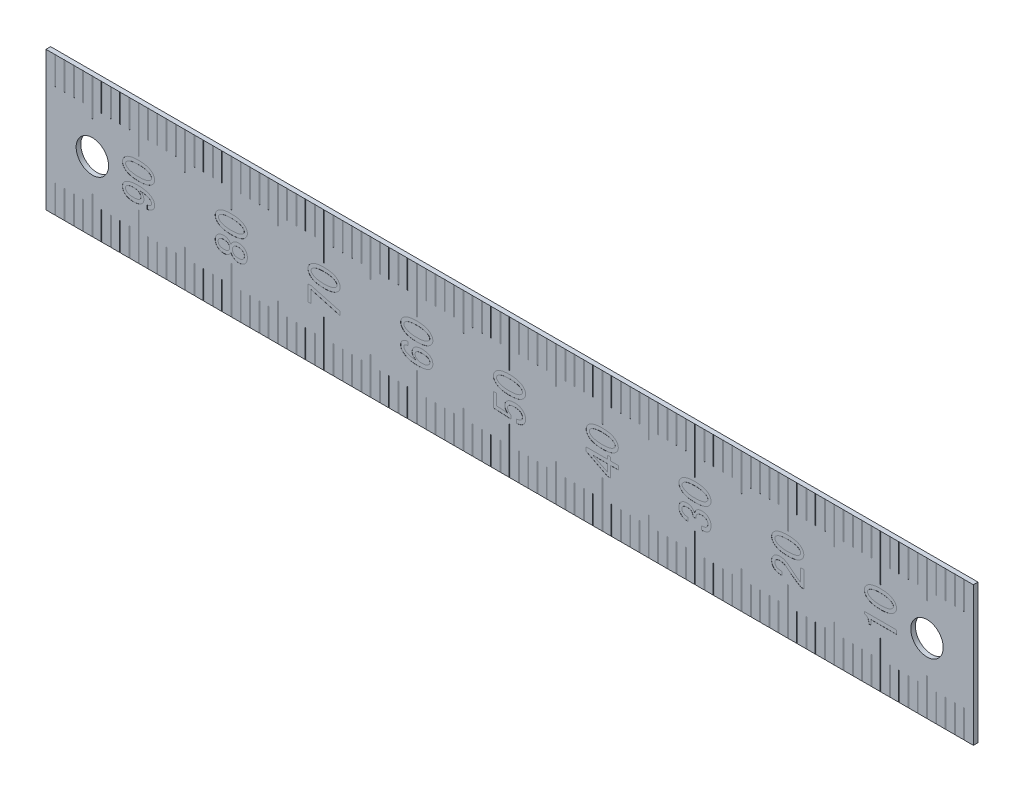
SolidWorks part; units mm, degrees
ref_plane "Front" through (0, 0, 0) normal (0, 0, 1) x (1, 0, 0)
ref_plane "Top" through (0, 0, 0) normal (0, 1, 0) x (1, 0, 0)
ref_plane "Right" through (0, 0, 0) normal (1, 0, 0) x (0, 0, -1)
sketch "Sketch1" plane through (0, 0, 0) normal (0, 0, 1) x (1, 0, 0)
  line L1 (0, -50) -> (0, 50)
  line L2 (0, -50) -> (15, -50)
  line L3 (15, -50) -> (15, 50)
  line L4 (0, 50) -> (15, 50)
  dimension "D1" = 100
  dimension "D2" = 15
extrude "Extrude1" add sketch "Sketch1" along normal blind 0.5
sketch "Sketch2" plane through (0, 0, 0.5) normal (0, 0, 1) x (1, 0, 0)
  line L0 (0, 50) -> (0, -50) construction
  line L1 (0, -50) -> (15, -50) construction
  line L2 (15, 50) -> (0, 50) construction
  circle A0 centre (7.5, -45) radius 1.75
  circle A1 centre (7.5, 45) radius 1.75
  dimension "D1" = 7.5
  dimension "D2" = 7.5
  dimension "D3" = 5
  dimension "D4" = 5
  dimension "D5" = 3.5
  dimension "D6" = 3.5
extrude "Extrude2" cut sketch "Sketch2" against normal through all
sketch "Sketch3" plane through (0, 0, 0.5) normal (0, 0, 1) x (1, 0, 0)
  line L0 (15, 50) -> (0, 50) construction
  line L1 (5.25, 28.25) -> (9.75, 28.25) construction
  line L2 (5.25, 18.25) -> (9.75, 18.25) construction
  line L3 (5.25, 8.25) -> (9.75, 8.25) construction
  line L5 (0, 50) -> (0, -50) construction
  line L6 (5.25, -1.75) -> (9.75, -1.75) construction
  line L7 (5.25, 38.25) -> (9.75, 38.25) construction
  line L8 (5.25, 38.25) -> (5.25, 41.75) construction
  line L9 (7.5, -50) -> (7.5, 50) construction
  line L10 (0, -50) -> (15, -50) construction
  line L11 (0, 40) -> (15, 40) construction
  line L12 (15, -50) -> (15, 50) construction
  line L13 (5.25, 41.75) -> (9.75, 41.75) construction
  line L14 (9.75, 38.25) -> (9.75, 41.75) construction
  line L15 (5.25, 38.25) -> (9.75, 41.75) construction
  line L16 (5.25, 41.75) -> (9.75, 38.25) construction
  line L17 (5.25, -11.75) -> (9.75, -11.75) construction
  line L18 (5.25, -21.75) -> (9.75, -21.75) construction
  line L19 (5.25, -31.75) -> (9.75, -31.75) construction
  line L20 (5.25, -41.75) -> (9.75, -41.75) construction
  circle A0 centre (7.5, 45) radius 1.75 construction
  text T0 "90" font "ＭＳ ゴシック" height 3.5
  text T1 "80" font "ＭＳ ゴシック" height 3.5
  text T2 "70" font "ＭＳ ゴシック" height 3.5
  text T3 "60" font "ＭＳ ゴシック" height 3.5
  text T4 "50  "
  text T5 "40"
  text T6 "30"
  text T7 "20"
  text T8 "10"
  point P7 (7.5, 40)
  dimension "D2" = 7.5
  dimension "D1" = 4
  dimension "D3" = 6
  dimension "D6" = 10
  dimension "D5" = 4.5
  dimension "D7" = 3.5
extrude "Extrude3" cut sketch "Sketch3" against normal blind 0.01
sketch "Sketch4" plane through (0, 0, 0.5) normal (0, 0, 1) x (1, 0, 0)
  line L0 (15, 40.05) -> (10, 40.05)
  line L1 (15, -50) -> (15, 50) construction
  line L2 (10, 40.05) -> (10, 39.95)
  line L3 (10, 39.95) -> (15, 39.95)
  line L4 (15, 39.95) -> (15, 40.05)
  line L5 (15, 50) -> (0, 50) construction
  line L6 (15, 48.05) -> (15, 47.95)
  line L7 (15, 44.95) -> (11, 44.95)
  line L8 (15, 44.95) -> (15, 45.05)
  line L9 (15, 45.05) -> (11, 45.05)
  line L10 (11, 44.95) -> (11, 45.05)
  line L11 (15, 49.05) -> (12, 49.05)
  line L12 (15, 49.05) -> (15, 48.95)
  line L13 (15, 48.95) -> (12, 48.95)
  line L14 (12, 49.05) -> (12, 48.95)
  line L15 (15, 48.05) -> (12, 48.05)
  line L16 (15, 47.95) -> (12, 47.95)
  line L17 (12, 48.05) -> (12, 47.95)
  line L18 (15, 47.05) -> (15, 46.95)
  line L19 (15, 47.05) -> (12, 47.05)
  line L20 (15, 46.95) -> (12, 46.95)
  line L21 (12, 47.05) -> (12, 46.95)
  line L22 (15, 46.05) -> (15, 45.95)
  line L23 (15, 46.05) -> (12, 46.05)
  line L24 (15, 45.95) -> (12, 45.95)
  line L25 (12, 46.05) -> (12, 45.95)
  line L26 (15, 30.05) -> (10, 30.05)
  line L27 (10, 30.05) -> (10, 29.95)
  line L28 (10, 29.95) -> (15, 29.95)
  line L29 (15, 29.95) -> (15, 30.05)
  line L30 (15, 44.05) -> (15, 43.95)
  line L31 (15, 44.05) -> (12, 44.05)
  line L32 (15, 43.95) -> (12, 43.95)
  line L33 (12, 44.05) -> (12, 43.95)
  line L34 (15, 43.05) -> (15, 42.95)
  line L35 (15, 43.05) -> (12, 43.05)
  line L36 (15, 42.95) -> (12, 42.95)
  line L37 (12, 43.05) -> (12, 42.95)
  line L38 (15, 42.05) -> (15, 41.95)
  line L39 (15, 42.05) -> (12, 42.05)
  line L40 (15, 41.95) -> (12, 41.95)
  line L41 (12, 42.05) -> (12, 41.95)
  line L42 (15, 41.05) -> (15, 40.95)
  line L43 (15, 41.05) -> (12, 41.05)
  line L44 (15, 40.95) -> (12, 40.95)
  line L45 (12, 41.05) -> (12, 40.95)
  line L46 (12, 45.05) -> (12, 44.95)
  line L47 (15, 45.05) -> (12, 45.05)
  line L48 (15, 44.95) -> (12, 44.95)
  line L49 (15, 45.05) -> (15, 44.95)
  line L50 (15, 38.05) -> (15, 37.95)
  line L51 (15, 34.95) -> (11, 34.95)
  line L52 (15, 34.95) -> (15, 35.05)
  line L53 (15, 35.05) -> (11, 35.05)
  line L54 (11, 34.95) -> (11, 35.05)
  line L55 (15, 39.05) -> (12, 39.05)
  line L56 (15, 39.05) -> (15, 38.95)
  line L57 (15, 38.95) -> (12, 38.95)
  line L58 (12, 39.05) -> (12, 38.95)
  line L59 (15, 38.05) -> (12, 38.05)
  line L60 (15, 37.95) -> (12, 37.95)
  line L61 (12, 38.05) -> (12, 37.95)
  line L62 (15, 37.05) -> (15, 36.95)
  line L63 (15, 37.05) -> (12, 37.05)
  line L64 (15, 36.95) -> (12, 36.95)
  line L65 (12, 37.05) -> (12, 36.95)
  line L66 (15, 36.05) -> (15, 35.95)
  line L67 (15, 36.05) -> (12, 36.05)
  line L68 (15, 35.95) -> (12, 35.95)
  line L69 (12, 36.05) -> (12, 35.95)
  line L70 (15, 34.05) -> (15, 33.95)
  line L71 (15, 34.05) -> (12, 34.05)
  line L72 (15, 33.95) -> (12, 33.95)
  line L73 (12, 34.05) -> (12, 33.95)
  line L74 (15, 33.05) -> (15, 32.95)
  line L75 (15, 33.05) -> (12, 33.05)
  line L76 (15, 32.95) -> (12, 32.95)
  line L77 (12, 33.05) -> (12, 32.95)
  line L78 (15, 32.05) -> (15, 31.95)
  line L79 (15, 32.05) -> (12, 32.05)
  line L80 (15, 31.95) -> (12, 31.95)
  line L81 (12, 32.05) -> (12, 31.95)
  line L82 (15, 31.05) -> (15, 30.95)
  line L83 (15, 31.05) -> (12, 31.05)
  line L84 (15, 30.95) -> (12, 30.95)
  line L85 (12, 31.05) -> (12, 30.95)
  line L86 (15, 20.05) -> (10, 20.05)
  line L87 (10, 20.05) -> (10, 19.95)
  line L88 (10, 19.95) -> (15, 19.95)
  line L89 (15, 19.95) -> (15, 20.05)
  line L90 (15, 28.05) -> (15, 27.95)
  line L91 (15, 24.95) -> (11, 24.95)
  line L92 (15, 24.95) -> (15, 25.05)
  line L93 (15, 25.05) -> (11, 25.05)
  line L94 (11, 24.95) -> (11, 25.05)
  line L95 (15, 29.05) -> (12, 29.05)
  line L96 (15, 29.05) -> (15, 28.95)
  line L97 (15, 28.95) -> (12, 28.95)
  line L98 (12, 29.05) -> (12, 28.95)
  line L99 (15, 28.05) -> (12, 28.05)
  line L100 (15, 27.95) -> (12, 27.95)
  line L101 (12, 28.05) -> (12, 27.95)
  line L102 (15, 27.05) -> (15, 26.95)
  line L103 (15, 27.05) -> (12, 27.05)
  line L104 (15, 26.95) -> (12, 26.95)
  line L105 (12, 27.05) -> (12, 26.95)
  line L106 (15, 26.05) -> (15, 25.95)
  line L107 (15, 26.05) -> (12, 26.05)
  line L108 (15, 25.95) -> (12, 25.95)
  line L109 (12, 26.05) -> (12, 25.95)
  line L110 (15, 24.05) -> (15, 23.95)
  line L111 (15, 24.05) -> (12, 24.05)
  line L112 (15, 23.95) -> (12, 23.95)
  line L113 (12, 24.05) -> (12, 23.95)
  line L114 (15, 23.05) -> (15, 22.95)
  line L115 (15, 23.05) -> (12, 23.05)
  line L116 (15, 22.95) -> (12, 22.95)
  line L117 (12, 23.05) -> (12, 22.95)
  line L118 (15, 22.05) -> (15, 21.95)
  line L119 (15, 22.05) -> (12, 22.05)
  line L120 (15, 21.95) -> (12, 21.95)
  line L121 (12, 22.05) -> (12, 21.95)
  line L122 (15, 21.05) -> (15, 20.95)
  line L123 (15, 21.05) -> (12, 21.05)
  line L124 (15, 20.95) -> (12, 20.95)
  line L125 (12, 21.05) -> (12, 20.95)
  line L126 (15, 10.05) -> (10, 10.05)
  line L127 (10, 10.05) -> (10, 9.95)
  line L128 (10, 9.95) -> (15, 9.95)
  line L129 (15, 9.95) -> (15, 10.05)
  line L130 (15, 18.05) -> (15, 17.95)
  line L131 (15, 14.95) -> (11, 14.95)
  line L132 (15, 14.95) -> (15, 15.05)
  line L133 (15, 15.05) -> (11, 15.05)
  line L134 (11, 14.95) -> (11, 15.05)
  line L135 (15, 19.05) -> (12, 19.05)
  line L136 (15, 19.05) -> (15, 18.95)
  line L137 (15, 18.95) -> (12, 18.95)
  line L138 (12, 19.05) -> (12, 18.95)
  line L139 (15, 18.05) -> (12, 18.05)
  line L140 (15, 17.95) -> (12, 17.95)
  line L141 (12, 18.05) -> (12, 17.95)
  line L142 (15, 17.05) -> (15, 16.95)
  line L143 (15, 17.05) -> (12, 17.05)
  line L144 (15, 16.95) -> (12, 16.95)
  line L145 (12, 17.05) -> (12, 16.95)
  line L146 (15, 16.05) -> (15, 15.95)
  line L147 (15, 16.05) -> (12, 16.05)
  line L148 (15, 15.95) -> (12, 15.95)
  line L149 (12, 16.05) -> (12, 15.95)
  line L150 (15, 14.05) -> (15, 13.95)
  line L151 (15, 14.05) -> (12, 14.05)
  line L152 (15, 13.95) -> (12, 13.95)
  line L153 (12, 14.05) -> (12, 13.95)
  line L154 (15, 13.05) -> (15, 12.95)
  line L155 (15, 13.05) -> (12, 13.05)
  line L156 (15, 12.95) -> (12, 12.95)
  line L157 (12, 13.05) -> (12, 12.95)
  line L158 (15, 12.05) -> (15, 11.95)
  line L159 (15, 12.05) -> (12, 12.05)
  line L160 (15, 11.95) -> (12, 11.95)
  line L161 (12, 12.05) -> (12, 11.95)
  line L162 (15, 11.05) -> (15, 10.95)
  line L163 (15, 11.05) -> (12, 11.05)
  line L164 (15, 10.95) -> (12, 10.95)
  line L165 (12, 11.05) -> (12, 10.95)
  line L166 (7.5, 50) -> (7.5, 36.693) construction
  line L167 (3, 1.05) -> (3, 0.95)
  line L168 (0, 0.95) -> (3, 0.95)
  line L169 (0, 1.05) -> (3, 1.05)
  line L170 (15, 8.05) -> (15, 7.95)
  line L171 (15, 4.95) -> (11, 4.95)
  line L172 (15, 4.95) -> (15, 5.05)
  line L173 (15, 5.05) -> (11, 5.05)
  line L174 (11, 4.95) -> (11, 5.05)
  line L175 (15, 9.05) -> (12, 9.05)
  line L176 (15, 9.05) -> (15, 8.95)
  line L177 (15, 8.95) -> (12, 8.95)
  line L178 (12, 9.05) -> (12, 8.95)
  line L179 (15, 8.05) -> (12, 8.05)
  line L180 (15, 7.95) -> (12, 7.95)
  line L181 (12, 8.05) -> (12, 7.95)
  line L182 (15, 7.05) -> (15, 6.95)
  line L183 (15, 7.05) -> (12, 7.05)
  line L184 (15, 6.95) -> (12, 6.95)
  line L185 (12, 7.05) -> (12, 6.95)
  line L186 (15, 6.05) -> (15, 5.95)
  line L187 (15, 6.05) -> (12, 6.05)
  line L188 (15, 5.95) -> (12, 5.95)
  line L189 (12, 6.05) -> (12, 5.95)
  line L190 (15, 4.05) -> (15, 3.95)
  line L191 (15, 4.05) -> (12, 4.05)
  line L192 (15, 3.95) -> (12, 3.95)
  line L193 (12, 4.05) -> (12, 3.95)
  line L194 (15, 3.05) -> (15, 2.95)
  line L195 (15, 3.05) -> (12, 3.05)
  line L196 (15, 2.95) -> (12, 2.95)
  line L197 (12, 3.05) -> (12, 2.95)
  line L198 (15, 2.05) -> (15, 1.95)
  line L199 (15, 2.05) -> (12, 2.05)
  line L200 (15, 1.95) -> (12, 1.95)
  line L201 (12, 2.05) -> (12, 1.95)
  line L202 (15, 1.05) -> (15, 0.95)
  line L203 (15, 1.05) -> (12, 1.05)
  line L204 (15, 0.95) -> (12, 0.95)
  line L205 (12, 1.05) -> (12, 0.95)
  line L206 (15, 0.05) -> (10, 0.05)
  line L207 (10, 0.05) -> (10, -0.05)
  line L208 (10, -0.05) -> (15, -0.05)
  line L209 (15, -0.05) -> (15, 0.05)
  line L210 (0, 1.05) -> (0, 0.95)
  line L211 (3, 2.05) -> (3, 1.95)
  line L212 (0, 1.95) -> (3, 1.95)
  line L213 (0, 2.05) -> (3, 2.05)
  line L214 (0, 2.05) -> (0, 1.95)
  line L215 (3, 3.05) -> (3, 2.95)
  line L216 (0, 2.95) -> (3, 2.95)
  line L217 (0, 3.05) -> (3, 3.05)
  line L218 (0, 3.05) -> (0, 2.95)
  line L219 (3, 4.05) -> (3, 3.95)
  line L220 (0, 3.95) -> (3, 3.95)
  line L221 (0, 4.05) -> (3, 4.05)
  line L222 (0, 4.05) -> (0, 3.95)
  line L223 (3, 6.05) -> (3, 5.95)
  line L224 (0, 5.95) -> (3, 5.95)
  line L225 (0, 6.05) -> (3, 6.05)
  line L226 (0, 6.05) -> (0, 5.95)
  line L227 (3, 7.05) -> (3, 6.95)
  line L228 (0, 6.95) -> (3, 6.95)
  line L229 (0, 7.05) -> (3, 7.05)
  line L230 (0, 7.05) -> (0, 6.95)
  line L231 (3, 8.05) -> (3, 7.95)
  line L232 (0, 7.95) -> (3, 7.95)
  line L233 (0, 8.05) -> (3, 8.05)
  line L234 (3, 9.05) -> (3, 8.95)
  line L235 (0, 8.95) -> (3, 8.95)
  line L236 (0, 9.05) -> (0, 8.95)
  line L237 (0, 9.05) -> (3, 9.05)
  line L238 (4, 4.95) -> (4, 5.05)
  line L239 (0, 5.05) -> (4, 5.05)
  line L240 (0, 4.95) -> (0, 5.05)
  line L241 (0, 4.95) -> (4, 4.95)
  line L242 (0, 8.05) -> (0, 7.95)
  line L243 (3, 11.05) -> (3, 10.95)
  line L244 (0, 10.95) -> (3, 10.95)
  line L245 (0, 11.05) -> (3, 11.05)
  line L246 (0, 11.05) -> (0, 10.95)
  line L247 (3, 12.05) -> (3, 11.95)
  line L248 (0, 11.95) -> (3, 11.95)
  line L249 (0, 12.05) -> (3, 12.05)
  line L250 (0, 12.05) -> (0, 11.95)
  line L251 (3, 13.05) -> (3, 12.95)
  line L252 (0, 12.95) -> (3, 12.95)
  line L253 (0, 13.05) -> (3, 13.05)
  line L254 (0, 13.05) -> (0, 12.95)
  line L255 (3, 14.05) -> (3, 13.95)
  line L256 (0, 13.95) -> (3, 13.95)
  line L257 (0, 14.05) -> (3, 14.05)
  line L258 (0, 14.05) -> (0, 13.95)
  line L259 (3, 16.05) -> (3, 15.95)
  line L260 (0, 15.95) -> (3, 15.95)
  line L261 (0, 16.05) -> (3, 16.05)
  line L262 (0, 16.05) -> (0, 15.95)
  line L263 (3, 17.05) -> (3, 16.95)
  line L264 (0, 16.95) -> (3, 16.95)
  line L265 (0, 17.05) -> (3, 17.05)
  line L266 (0, 17.05) -> (0, 16.95)
  line L267 (3, 18.05) -> (3, 17.95)
  line L268 (0, 17.95) -> (3, 17.95)
  line L269 (0, 18.05) -> (3, 18.05)
  line L270 (3, 19.05) -> (3, 18.95)
  line L271 (0, 18.95) -> (3, 18.95)
  line L272 (0, 19.05) -> (0, 18.95)
  line L273 (0, 19.05) -> (3, 19.05)
  line L274 (4, 14.95) -> (4, 15.05)
  line L275 (0, 15.05) -> (4, 15.05)
  line L276 (0, 14.95) -> (0, 15.05)
  line L277 (0, 14.95) -> (4, 14.95)
  line L278 (0, 18.05) -> (0, 17.95)
  line L279 (0, 9.95) -> (0, 10.05)
  line L280 (5, 9.95) -> (0, 9.95)
  line L281 (5, 10.05) -> (5, 9.95)
  line L282 (0, 10.05) -> (5, 10.05)
  line L283 (3, 21.05) -> (3, 20.95)
  line L284 (0, 20.95) -> (3, 20.95)
  line L285 (0, 21.05) -> (3, 21.05)
  line L286 (0, 21.05) -> (0, 20.95)
  line L287 (3, 22.05) -> (3, 21.95)
  line L288 (0, 21.95) -> (3, 21.95)
  line L289 (0, 22.05) -> (3, 22.05)
  line L290 (0, 22.05) -> (0, 21.95)
  line L291 (3, 23.05) -> (3, 22.95)
  line L292 (0, 22.95) -> (3, 22.95)
  line L293 (0, 23.05) -> (3, 23.05)
  line L294 (0, 23.05) -> (0, 22.95)
  line L295 (3, 24.05) -> (3, 23.95)
  line L296 (0, 23.95) -> (3, 23.95)
  line L297 (0, 24.05) -> (3, 24.05)
  line L298 (0, 24.05) -> (0, 23.95)
  line L299 (3, 26.05) -> (3, 25.95)
  line L300 (0, 25.95) -> (3, 25.95)
  line L301 (0, 26.05) -> (3, 26.05)
  line L302 (0, 26.05) -> (0, 25.95)
  line L303 (3, 27.05) -> (3, 26.95)
  line L304 (0, 26.95) -> (3, 26.95)
  line L305 (0, 27.05) -> (3, 27.05)
  line L306 (0, 27.05) -> (0, 26.95)
  line L307 (3, 28.05) -> (3, 27.95)
  line L308 (0, 27.95) -> (3, 27.95)
  line L309 (0, 28.05) -> (3, 28.05)
  line L310 (3, 29.05) -> (3, 28.95)
  line L311 (0, 28.95) -> (3, 28.95)
  line L312 (0, 29.05) -> (0, 28.95)
  line L313 (0, 29.05) -> (3, 29.05)
  line L314 (4, 24.95) -> (4, 25.05)
  line L315 (0, 25.05) -> (4, 25.05)
  line L316 (0, 24.95) -> (0, 25.05)
  line L317 (0, 24.95) -> (4, 24.95)
  line L318 (0, 28.05) -> (0, 27.95)
  line L319 (0, 19.95) -> (0, 20.05)
  line L320 (5, 19.95) -> (0, 19.95)
  line L321 (5, 20.05) -> (5, 19.95)
  line L322 (0, 20.05) -> (5, 20.05)
  line L323 (3, 31.05) -> (3, 30.95)
  line L324 (0, 30.95) -> (3, 30.95)
  line L325 (0, 31.05) -> (3, 31.05)
  line L326 (0, 31.05) -> (0, 30.95)
  line L327 (3, 32.05) -> (3, 31.95)
  line L328 (0, 31.95) -> (3, 31.95)
  line L329 (0, 32.05) -> (3, 32.05)
  line L330 (0, 32.05) -> (0, 31.95)
  line L331 (3, 33.05) -> (3, 32.95)
  line L332 (0, 32.95) -> (3, 32.95)
  line L333 (0, 33.05) -> (3, 33.05)
  line L334 (0, 33.05) -> (0, 32.95)
  line L335 (3, 34.05) -> (3, 33.95)
  line L336 (0, 33.95) -> (3, 33.95)
  line L337 (0, 34.05) -> (3, 34.05)
  line L338 (0, 34.05) -> (0, 33.95)
  line L339 (3, 36.05) -> (3, 35.95)
  line L340 (0, 35.95) -> (3, 35.95)
  line L341 (0, 36.05) -> (3, 36.05)
  line L342 (0, 36.05) -> (0, 35.95)
  line L343 (3, 37.05) -> (3, 36.95)
  line L344 (0, 36.95) -> (3, 36.95)
  line L345 (0, 37.05) -> (3, 37.05)
  line L346 (0, 37.05) -> (0, 36.95)
  line L347 (3, 38.05) -> (3, 37.95)
  line L348 (0, 37.95) -> (3, 37.95)
  line L349 (0, 38.05) -> (3, 38.05)
  line L350 (3, 39.05) -> (3, 38.95)
  line L351 (0, 38.95) -> (3, 38.95)
  line L352 (0, 39.05) -> (0, 38.95)
  line L353 (0, 39.05) -> (3, 39.05)
  line L354 (4, 34.95) -> (4, 35.05)
  line L355 (0, 35.05) -> (4, 35.05)
  line L356 (0, 34.95) -> (0, 35.05)
  line L357 (0, 34.95) -> (4, 34.95)
  line L358 (0, 38.05) -> (0, 37.95)
  line L359 (3, 41.05) -> (3, 40.95)
  line L360 (0, 40.95) -> (3, 40.95)
  line L361 (0, 41.05) -> (3, 41.05)
  line L362 (0, 41.05) -> (0, 40.95)
  line L363 (3, 42.05) -> (3, 41.95)
  line L364 (0, 41.95) -> (3, 41.95)
  line L365 (0, 42.05) -> (3, 42.05)
  line L366 (0, 42.05) -> (0, 41.95)
  line L367 (3, 43.05) -> (3, 42.95)
  line L368 (0, 42.95) -> (3, 42.95)
  line L369 (0, 43.05) -> (3, 43.05)
  line L370 (0, 43.05) -> (0, 42.95)
  line L371 (3, 44.05) -> (3, 43.95)
  line L372 (0, 43.95) -> (3, 43.95)
  line L373 (0, 44.05) -> (3, 44.05)
  line L374 (0, 44.05) -> (0, 43.95)
  line L375 (0, 29.95) -> (0, 30.05)
  line L376 (5, 29.95) -> (0, 29.95)
  line L377 (5, 30.05) -> (5, 29.95)
  line L378 (0, 30.05) -> (5, 30.05)
  line L379 (3, 46.05) -> (3, 45.95)
  line L380 (0, 45.95) -> (3, 45.95)
  line L381 (0, 46.05) -> (3, 46.05)
  line L382 (0, 46.05) -> (0, 45.95)
  line L383 (3, 47.05) -> (3, 46.95)
  line L384 (0, 46.95) -> (3, 46.95)
  line L385 (0, 47.05) -> (3, 47.05)
  line L386 (0, 47.05) -> (0, 46.95)
  line L387 (3, 48.05) -> (3, 47.95)
  line L388 (0, 47.95) -> (3, 47.95)
  line L389 (0, 48.05) -> (3, 48.05)
  line L390 (3, 49.05) -> (3, 48.95)
  line L391 (0, 48.95) -> (3, 48.95)
  line L392 (0, 49.05) -> (0, 48.95)
  line L393 (0, 49.05) -> (3, 49.05)
  line L394 (4, 44.95) -> (4, 45.05)
  line L395 (0, 45.05) -> (4, 45.05)
  line L396 (0, 44.95) -> (0, 45.05)
  line L397 (0, 44.95) -> (4, 44.95)
  line L398 (0, 48.05) -> (0, 47.95)
  line L399 (0, 39.95) -> (0, 40.05)
  line L400 (5, 39.95) -> (0, 39.95)
  line L401 (5, 40.05) -> (5, 39.95)
  line L402 (0, 40.05) -> (5, 40.05)
  line L403 (15, 0.05) -> (10, 0.05)
  line L404 (10, 0.05) -> (10, -0.05)
  line L405 (10, -0.05) -> (15, -0.05)
  line L406 (15, -0.05) -> (15, 0.05)
  line L407 (3, -8.95) -> (3, -9.05)
  line L408 (0, -9.05) -> (3, -9.05)
  line L409 (0, -8.95) -> (3, -8.95)
  line L410 (15, -1.95) -> (15, -2.05)
  line L411 (15, -5.05) -> (11, -5.05)
  line L412 (15, -5.05) -> (15, -4.95)
  line L413 (15, -4.95) -> (11, -4.95)
  line L414 (11, -5.05) -> (11, -4.95)
  line L415 (15, -0.95) -> (12, -0.95)
  line L416 (15, -0.95) -> (15, -1.05)
  line L417 (15, -1.05) -> (12, -1.05)
  line L418 (12, -0.95) -> (12, -1.05)
  line L419 (15, -1.95) -> (12, -1.95)
  line L420 (15, -2.05) -> (12, -2.05)
  line L421 (12, -1.95) -> (12, -2.05)
  line L422 (15, -2.95) -> (15, -3.05)
  line L423 (15, -2.95) -> (12, -2.95)
  line L424 (15, -3.05) -> (12, -3.05)
  line L425 (12, -2.95) -> (12, -3.05)
  line L426 (15, -3.95) -> (15, -4.05)
  line L427 (15, -3.95) -> (12, -3.95)
  line L428 (15, -4.05) -> (12, -4.05)
  line L429 (12, -3.95) -> (12, -4.05)
  line L430 (15, -5.95) -> (15, -6.05)
  line L431 (15, -5.95) -> (12, -5.95)
  line L432 (15, -6.05) -> (12, -6.05)
  line L433 (12, -5.95) -> (12, -6.05)
  line L434 (15, -6.95) -> (15, -7.05)
  line L435 (15, -6.95) -> (12, -6.95)
  line L436 (15, -7.05) -> (12, -7.05)
  line L437 (12, -6.95) -> (12, -7.05)
  line L438 (15, -7.95) -> (15, -8.05)
  line L439 (15, -7.95) -> (12, -7.95)
  line L440 (15, -8.05) -> (12, -8.05)
  line L441 (12, -7.95) -> (12, -8.05)
  line L442 (15, -8.95) -> (15, -9.05)
  line L443 (15, -8.95) -> (12, -8.95)
  line L444 (15, -9.05) -> (12, -9.05)
  line L445 (12, -8.95) -> (12, -9.05)
  line L446 (0, -8.95) -> (0, -9.05)
  line L447 (3, -7.95) -> (3, -8.05)
  line L448 (0, -8.05) -> (3, -8.05)
  line L449 (0, -7.95) -> (3, -7.95)
  line L450 (0, -7.95) -> (0, -8.05)
  line L451 (3, -6.95) -> (3, -7.05)
  line L452 (0, -7.05) -> (3, -7.05)
  line L453 (0, -6.95) -> (3, -6.95)
  line L454 (0, -6.95) -> (0, -7.05)
  line L455 (3, -5.95) -> (3, -6.05)
  line L456 (0, -6.05) -> (3, -6.05)
  line L457 (0, -5.95) -> (3, -5.95)
  line L458 (0, -5.95) -> (0, -6.05)
  line L459 (3, -3.95) -> (3, -4.05)
  line L460 (0, -4.05) -> (3, -4.05)
  line L461 (0, -3.95) -> (3, -3.95)
  line L462 (0, -3.95) -> (0, -4.05)
  line L463 (3, -2.95) -> (3, -3.05)
  line L464 (0, -3.05) -> (3, -3.05)
  line L465 (0, -2.95) -> (3, -2.95)
  line L466 (0, -2.95) -> (0, -3.05)
  line L467 (3, -1.95) -> (3, -2.05)
  line L468 (0, -2.05) -> (3, -2.05)
  line L469 (0, -1.95) -> (3, -1.95)
  line L470 (3, -0.95) -> (3, -1.05)
  line L471 (0, -1.05) -> (3, -1.05)
  line L472 (0, -0.95) -> (0, -1.05)
  line L473 (0, -0.95) -> (3, -0.95)
  line L474 (4, -5.05) -> (4, -4.95)
  line L475 (0, -4.95) -> (4, -4.95)
  line L476 (0, -5.05) -> (0, -4.95)
  line L477 (0, -5.05) -> (4, -5.05)
  line L478 (0, -1.95) -> (0, -2.05)
  line L479 (0, -0.05) -> (0, 0.05)
  line L480 (5, -0.05) -> (0, -0.05)
  line L481 (5, 0.05) -> (5, -0.05)
  line L482 (0, 0.05) -> (5, 0.05)
  line L483 (15, -9.95) -> (10, -9.95)
  line L484 (10, -9.95) -> (10, -10.05)
  line L485 (10, -10.05) -> (15, -10.05)
  line L486 (15, -10.05) -> (15, -9.95)
  line L487 (3, -18.95) -> (3, -19.05)
  line L488 (0, -19.05) -> (3, -19.05)
  line L489 (0, -18.95) -> (3, -18.95)
  line L490 (15, -11.95) -> (15, -12.05)
  line L491 (15, -15.05) -> (11, -15.05)
  line L492 (15, -15.05) -> (15, -14.95)
  line L493 (15, -14.95) -> (11, -14.95)
  line L494 (11, -15.05) -> (11, -14.95)
  line L495 (15, -10.95) -> (12, -10.95)
  line L496 (15, -10.95) -> (15, -11.05)
  line L497 (15, -11.05) -> (12, -11.05)
  line L498 (12, -10.95) -> (12, -11.05)
  line L499 (15, -11.95) -> (12, -11.95)
  line L500 (15, -12.05) -> (12, -12.05)
  line L501 (12, -11.95) -> (12, -12.05)
  line L502 (15, -12.95) -> (15, -13.05)
  line L503 (15, -12.95) -> (12, -12.95)
  line L504 (15, -13.05) -> (12, -13.05)
  line L505 (12, -12.95) -> (12, -13.05)
  line L506 (15, -13.95) -> (15, -14.05)
  line L507 (15, -13.95) -> (12, -13.95)
  line L508 (15, -14.05) -> (12, -14.05)
  line L509 (12, -13.95) -> (12, -14.05)
  line L510 (15, -15.95) -> (15, -16.05)
  line L511 (15, -15.95) -> (12, -15.95)
  line L512 (15, -16.05) -> (12, -16.05)
  line L513 (12, -15.95) -> (12, -16.05)
  line L514 (15, -16.95) -> (15, -17.05)
  line L515 (15, -16.95) -> (12, -16.95)
  line L516 (15, -17.05) -> (12, -17.05)
  line L517 (12, -16.95) -> (12, -17.05)
  line L518 (15, -17.95) -> (15, -18.05)
  line L519 (15, -17.95) -> (12, -17.95)
  line L520 (15, -18.05) -> (12, -18.05)
  line L521 (12, -17.95) -> (12, -18.05)
  line L522 (15, -18.95) -> (15, -19.05)
  line L523 (15, -18.95) -> (12, -18.95)
  line L524 (15, -19.05) -> (12, -19.05)
  line L525 (12, -18.95) -> (12, -19.05)
  line L526 (0, -18.95) -> (0, -19.05)
  line L527 (3, -17.95) -> (3, -18.05)
  line L528 (0, -18.05) -> (3, -18.05)
  line L529 (0, -17.95) -> (3, -17.95)
  line L530 (0, -17.95) -> (0, -18.05)
  line L531 (3, -16.95) -> (3, -17.05)
  line L532 (0, -17.05) -> (3, -17.05)
  line L533 (0, -16.95) -> (3, -16.95)
  line L534 (0, -16.95) -> (0, -17.05)
  line L535 (3, -15.95) -> (3, -16.05)
  line L536 (0, -16.05) -> (3, -16.05)
  line L537 (0, -15.95) -> (3, -15.95)
  line L538 (0, -15.95) -> (0, -16.05)
  line L539 (3, -13.95) -> (3, -14.05)
  line L540 (0, -14.05) -> (3, -14.05)
  line L541 (0, -13.95) -> (3, -13.95)
  line L542 (0, -13.95) -> (0, -14.05)
  line L543 (3, -12.95) -> (3, -13.05)
  line L544 (0, -13.05) -> (3, -13.05)
  line L545 (0, -12.95) -> (3, -12.95)
  line L546 (0, -12.95) -> (0, -13.05)
  line L547 (3, -11.95) -> (3, -12.05)
  line L548 (0, -12.05) -> (3, -12.05)
  line L549 (0, -11.95) -> (3, -11.95)
  line L550 (3, -10.95) -> (3, -11.05)
  line L551 (0, -11.05) -> (3, -11.05)
  line L552 (0, -10.95) -> (0, -11.05)
  line L553 (0, -10.95) -> (3, -10.95)
  line L554 (4, -15.05) -> (4, -14.95)
  line L555 (0, -14.95) -> (4, -14.95)
  line L556 (0, -15.05) -> (0, -14.95)
  line L557 (0, -15.05) -> (4, -15.05)
  line L558 (0, -11.95) -> (0, -12.05)
  line L559 (0, -10.05) -> (0, -9.95)
  line L560 (5, -10.05) -> (0, -10.05)
  line L561 (5, -9.95) -> (5, -10.05)
  line L562 (0, -9.95) -> (5, -9.95)
  line L563 (15, -19.95) -> (10, -19.95)
  line L564 (10, -19.95) -> (10, -20.05)
  line L565 (10, -20.05) -> (15, -20.05)
  line L566 (15, -20.05) -> (15, -19.95)
  line L567 (3, -28.95) -> (3, -29.05)
  line L568 (0, -29.05) -> (3, -29.05)
  line L569 (0, -28.95) -> (3, -28.95)
  line L570 (15, -21.95) -> (15, -22.05)
  line L571 (15, -25.05) -> (11, -25.05)
  line L572 (15, -25.05) -> (15, -24.95)
  line L573 (15, -24.95) -> (11, -24.95)
  line L574 (11, -25.05) -> (11, -24.95)
  line L575 (15, -20.95) -> (12, -20.95)
  line L576 (15, -20.95) -> (15, -21.05)
  line L577 (15, -21.05) -> (12, -21.05)
  line L578 (12, -20.95) -> (12, -21.05)
  line L579 (15, -21.95) -> (12, -21.95)
  line L580 (15, -22.05) -> (12, -22.05)
  line L581 (12, -21.95) -> (12, -22.05)
  line L582 (15, -22.95) -> (15, -23.05)
  line L583 (15, -22.95) -> (12, -22.95)
  line L584 (15, -23.05) -> (12, -23.05)
  line L585 (12, -22.95) -> (12, -23.05)
  line L586 (15, -23.95) -> (15, -24.05)
  line L587 (15, -23.95) -> (12, -23.95)
  line L588 (15, -24.05) -> (12, -24.05)
  line L589 (12, -23.95) -> (12, -24.05)
  line L590 (15, -25.95) -> (15, -26.05)
  line L591 (15, -25.95) -> (12, -25.95)
  line L592 (15, -26.05) -> (12, -26.05)
  line L593 (12, -25.95) -> (12, -26.05)
  line L594 (15, -26.95) -> (15, -27.05)
  line L595 (15, -26.95) -> (12, -26.95)
  line L596 (15, -27.05) -> (12, -27.05)
  line L597 (12, -26.95) -> (12, -27.05)
  line L598 (15, -27.95) -> (15, -28.05)
  line L599 (15, -27.95) -> (12, -27.95)
  line L600 (15, -28.05) -> (12, -28.05)
  line L601 (12, -27.95) -> (12, -28.05)
  line L602 (15, -28.95) -> (15, -29.05)
  line L603 (15, -28.95) -> (12, -28.95)
  line L604 (15, -29.05) -> (12, -29.05)
  line L605 (12, -28.95) -> (12, -29.05)
  line L606 (0, -28.95) -> (0, -29.05)
  line L607 (3, -27.95) -> (3, -28.05)
  line L608 (0, -28.05) -> (3, -28.05)
  line L609 (0, -27.95) -> (3, -27.95)
  line L610 (0, -27.95) -> (0, -28.05)
  line L611 (3, -26.95) -> (3, -27.05)
  line L612 (0, -27.05) -> (3, -27.05)
  line L613 (0, -26.95) -> (3, -26.95)
  line L614 (0, -26.95) -> (0, -27.05)
  line L615 (3, -25.95) -> (3, -26.05)
  line L616 (0, -26.05) -> (3, -26.05)
  line L617 (0, -25.95) -> (3, -25.95)
  line L618 (0, -25.95) -> (0, -26.05)
  line L619 (3, -23.95) -> (3, -24.05)
  line L620 (0, -24.05) -> (3, -24.05)
  line L621 (0, -23.95) -> (3, -23.95)
  line L622 (0, -23.95) -> (0, -24.05)
  line L623 (3, -22.95) -> (3, -23.05)
  line L624 (0, -23.05) -> (3, -23.05)
  line L625 (0, -22.95) -> (3, -22.95)
  line L626 (0, -22.95) -> (0, -23.05)
  line L627 (3, -21.95) -> (3, -22.05)
  line L628 (0, -22.05) -> (3, -22.05)
  line L629 (0, -21.95) -> (3, -21.95)
  line L630 (3, -20.95) -> (3, -21.05)
  line L631 (0, -21.05) -> (3, -21.05)
  line L632 (0, -20.95) -> (0, -21.05)
  line L633 (0, -20.95) -> (3, -20.95)
  line L634 (4, -25.05) -> (4, -24.95)
  line L635 (0, -24.95) -> (4, -24.95)
  line L636 (0, -25.05) -> (0, -24.95)
  line L637 (0, -25.05) -> (4, -25.05)
  line L638 (0, -21.95) -> (0, -22.05)
  line L639 (0, -20.05) -> (0, -19.95)
  line L640 (5, -20.05) -> (0, -20.05)
  line L641 (5, -19.95) -> (5, -20.05)
  line L642 (0, -19.95) -> (5, -19.95)
  line L643 (15, -29.95) -> (10, -29.95)
  line L644 (10, -29.95) -> (10, -30.05)
  line L645 (10, -30.05) -> (15, -30.05)
  line L646 (15, -30.05) -> (15, -29.95)
  line L647 (3, -38.95) -> (3, -39.05)
  line L648 (0, -39.05) -> (3, -39.05)
  line L649 (0, -38.95) -> (3, -38.95)
  line L650 (15, -31.95) -> (15, -32.05)
  line L651 (15, -35.05) -> (11, -35.05)
  line L652 (15, -35.05) -> (15, -34.95)
  line L653 (15, -34.95) -> (11, -34.95)
  line L654 (11, -35.05) -> (11, -34.95)
  line L655 (15, -30.95) -> (12, -30.95)
  line L656 (15, -30.95) -> (15, -31.05)
  line L657 (15, -31.05) -> (12, -31.05)
  line L658 (12, -30.95) -> (12, -31.05)
  line L659 (15, -31.95) -> (12, -31.95)
  line L660 (15, -32.05) -> (12, -32.05)
  line L661 (12, -31.95) -> (12, -32.05)
  line L662 (15, -32.95) -> (15, -33.05)
  line L663 (15, -32.95) -> (12, -32.95)
  line L664 (15, -33.05) -> (12, -33.05)
  line L665 (12, -32.95) -> (12, -33.05)
  line L666 (15, -33.95) -> (15, -34.05)
  line L667 (15, -33.95) -> (12, -33.95)
  line L668 (15, -34.05) -> (12, -34.05)
  line L669 (12, -33.95) -> (12, -34.05)
  line L670 (15, -35.95) -> (15, -36.05)
  line L671 (15, -35.95) -> (12, -35.95)
  line L672 (15, -36.05) -> (12, -36.05)
  line L673 (12, -35.95) -> (12, -36.05)
  line L674 (15, -36.95) -> (15, -37.05)
  line L675 (15, -36.95) -> (12, -36.95)
  line L676 (15, -37.05) -> (12, -37.05)
  line L677 (12, -36.95) -> (12, -37.05)
  line L678 (15, -37.95) -> (15, -38.05)
  line L679 (15, -37.95) -> (12, -37.95)
  line L680 (15, -38.05) -> (12, -38.05)
  line L681 (12, -37.95) -> (12, -38.05)
  line L682 (15, -38.95) -> (15, -39.05)
  line L683 (15, -38.95) -> (12, -38.95)
  line L684 (15, -39.05) -> (12, -39.05)
  line L685 (12, -38.95) -> (12, -39.05)
  line L686 (0, -38.95) -> (0, -39.05)
  line L687 (3, -37.95) -> (3, -38.05)
  line L688 (0, -38.05) -> (3, -38.05)
  line L689 (0, -37.95) -> (3, -37.95)
  line L690 (0, -37.95) -> (0, -38.05)
  line L691 (3, -36.95) -> (3, -37.05)
  line L692 (0, -37.05) -> (3, -37.05)
  line L693 (0, -36.95) -> (3, -36.95)
  line L694 (0, -36.95) -> (0, -37.05)
  line L695 (3, -35.95) -> (3, -36.05)
  line L696 (0, -36.05) -> (3, -36.05)
  line L697 (0, -35.95) -> (3, -35.95)
  line L698 (0, -35.95) -> (0, -36.05)
  line L699 (3, -33.95) -> (3, -34.05)
  line L700 (0, -34.05) -> (3, -34.05)
  line L701 (0, -33.95) -> (3, -33.95)
  line L702 (0, -33.95) -> (0, -34.05)
  line L703 (3, -32.95) -> (3, -33.05)
  line L704 (0, -33.05) -> (3, -33.05)
  line L705 (0, -32.95) -> (3, -32.95)
  line L706 (0, -32.95) -> (0, -33.05)
  line L707 (3, -31.95) -> (3, -32.05)
  line L708 (0, -32.05) -> (3, -32.05)
  line L709 (0, -31.95) -> (3, -31.95)
  line L710 (3, -30.95) -> (3, -31.05)
  line L711 (0, -31.05) -> (3, -31.05)
  line L712 (0, -30.95) -> (0, -31.05)
  line L713 (0, -30.95) -> (3, -30.95)
  line L714 (4, -35.05) -> (4, -34.95)
  line L715 (0, -34.95) -> (4, -34.95)
  line L716 (0, -35.05) -> (0, -34.95)
  line L717 (0, -35.05) -> (4, -35.05)
  line L718 (0, -31.95) -> (0, -32.05)
  line L719 (0, -30.05) -> (0, -29.95)
  line L720 (5, -30.05) -> (0, -30.05)
  line L721 (5, -29.95) -> (5, -30.05)
  line L722 (0, -29.95) -> (5, -29.95)
  line L723 (15, -39.95) -> (10, -39.95)
  line L724 (10, -39.95) -> (10, -40.05)
  line L725 (10, -40.05) -> (15, -40.05)
  line L726 (15, -40.05) -> (15, -39.95)
  line L727 (3, -48.95) -> (3, -49.05)
  line L728 (0, -49.05) -> (3, -49.05)
  line L729 (0, -48.95) -> (3, -48.95)
  line L730 (15, -41.95) -> (15, -42.05)
  line L731 (15, -45.05) -> (11, -45.05)
  line L732 (15, -45.05) -> (15, -44.95)
  line L733 (15, -44.95) -> (11, -44.95)
  line L734 (11, -45.05) -> (11, -44.95)
  line L735 (15, -40.95) -> (12, -40.95)
  line L736 (15, -40.95) -> (15, -41.05)
  line L737 (15, -41.05) -> (12, -41.05)
  line L738 (12, -40.95) -> (12, -41.05)
  line L739 (15, -41.95) -> (12, -41.95)
  line L740 (15, -42.05) -> (12, -42.05)
  line L741 (12, -41.95) -> (12, -42.05)
  line L742 (15, -42.95) -> (15, -43.05)
  line L743 (15, -42.95) -> (12, -42.95)
  line L744 (15, -43.05) -> (12, -43.05)
  line L745 (12, -42.95) -> (12, -43.05)
  line L746 (15, -43.95) -> (15, -44.05)
  line L747 (15, -43.95) -> (12, -43.95)
  line L748 (15, -44.05) -> (12, -44.05)
  line L749 (12, -43.95) -> (12, -44.05)
  line L750 (15, -45.95) -> (15, -46.05)
  line L751 (15, -45.95) -> (12, -45.95)
  line L752 (15, -46.05) -> (12, -46.05)
  line L753 (12, -45.95) -> (12, -46.05)
  line L754 (15, -46.95) -> (15, -47.05)
  line L755 (15, -46.95) -> (12, -46.95)
  line L756 (15, -47.05) -> (12, -47.05)
  line L757 (12, -46.95) -> (12, -47.05)
  line L758 (15, -47.95) -> (15, -48.05)
  line L759 (15, -47.95) -> (12, -47.95)
  line L760 (15, -48.05) -> (12, -48.05)
  line L761 (12, -47.95) -> (12, -48.05)
  line L762 (15, -48.95) -> (15, -49.05)
  line L763 (15, -48.95) -> (12, -48.95)
  line L764 (15, -49.05) -> (12, -49.05)
  line L765 (12, -48.95) -> (12, -49.05)
  line L766 (0, -48.95) -> (0, -49.05)
  line L767 (3, -47.95) -> (3, -48.05)
  line L768 (0, -48.05) -> (3, -48.05)
  line L769 (0, -47.95) -> (3, -47.95)
  line L770 (0, -47.95) -> (0, -48.05)
  line L771 (3, -46.95) -> (3, -47.05)
  line L772 (0, -47.05) -> (3, -47.05)
  line L773 (0, -46.95) -> (3, -46.95)
  line L774 (0, -46.95) -> (0, -47.05)
  line L775 (3, -45.95) -> (3, -46.05)
  line L776 (0, -46.05) -> (3, -46.05)
  line L777 (0, -45.95) -> (3, -45.95)
  line L778 (0, -45.95) -> (0, -46.05)
  line L779 (3, -43.95) -> (3, -44.05)
  line L780 (0, -44.05) -> (3, -44.05)
  line L781 (0, -43.95) -> (3, -43.95)
  line L782 (0, -43.95) -> (0, -44.05)
  line L783 (3, -42.95) -> (3, -43.05)
  line L784 (0, -43.05) -> (3, -43.05)
  line L785 (0, -42.95) -> (3, -42.95)
  line L786 (0, -42.95) -> (0, -43.05)
  line L787 (3, -41.95) -> (3, -42.05)
  line L788 (0, -42.05) -> (3, -42.05)
  line L789 (0, -41.95) -> (3, -41.95)
  line L790 (3, -40.95) -> (3, -41.05)
  line L791 (0, -41.05) -> (3, -41.05)
  line L792 (0, -40.95) -> (0, -41.05)
  line L793 (0, -40.95) -> (3, -40.95)
  line L794 (4, -45.05) -> (4, -44.95)
  line L795 (0, -44.95) -> (4, -44.95)
  line L796 (0, -45.05) -> (0, -44.95)
  line L797 (0, -45.05) -> (4, -45.05)
  line L798 (0, -41.95) -> (0, -42.05)
  line L799 (0, -40.05) -> (0, -39.95)
  line L800 (5, -40.05) -> (0, -40.05)
  line L801 (5, -39.95) -> (5, -40.05)
  line L802 (0, -39.95) -> (5, -39.95)
  point P4 (15, 40)
  point P13 (15, 45)
  point P18 (15, 49)
  dimension "D1" = 10
  dimension "D2" = 0.1
  dimension "D3" = 5
  dimension "D4" = 5
  dimension "D5" = 0.1
  dimension "D6" = 1
  dimension "D7" = 0.1
  dimension "D8" = 3
  dimension "D9" = 4
  dimension "D12" = 6
  dimension "D10" = 9
  dimension "D11" = 5
extrude "Extrude4" cut sketch "Sketch4" against normal blind 0.01
move or copy body "Body-Move/Copy2" bodies to move or copy 105 copy no rotation origin (0, 0, 0) rotation axis (0, 0, 1) rotation angle 90
move or copy body "Body-Move/Copy3" bodies to move or copy 107 copy no translate (-50, -7.5, 0)
